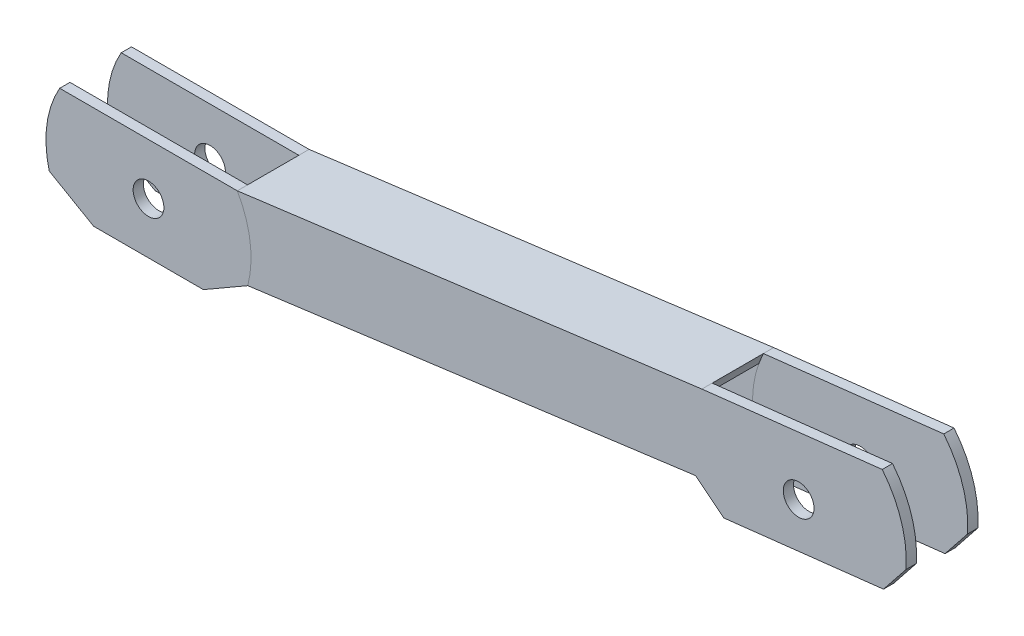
SolidWorks part; units mm, degrees
ref_plane "Plan de face" through (0, 0, 0) normal (0, 0, 1) x (1, 0, 0)
ref_plane "Plan de dessus" through (0, 0, 0) normal (0, 1, 0) x (1, 0, 0)
ref_plane "Plan de droite" through (0, 0, 0) normal (1, 0, 0) x (0, 0, -1)
sketch "Esquisse1" plane through (0, 0, 0) normal (0, 0, 1) x (1, 0, 0)
  line L0 (634, 63) -> (0, 0) construction
  point P0 (634, 63)
  point P1 (0, 0)
  dimension "D1" = 63
  dimension "D2" = 634
sketch "Esquisse2" plane through (0, 0, 0) normal (0, 0, 1) x (1, 0, 0)
  line L0 (0, -131.6719) -> (0, 145.07) construction
  line L1 (-157.388, 0) -> (129.7806, 0) construction
  line L2 (-86.6025, 50) -> (86.6025, 50)
  line L3 (-53.5233, -50) -> (53.5233, -50)
  line L4 (96.8246, -25) -> (53.5233, -50)
  line L5 (-96.8246, -25) -> (-53.5233, -50)
  circle A0 centre (0, 0) radius 15
  arc A1 (-86.6025, 50) -> (-96.8246, -25) centre (0, 0) ccw
  arc A2 (96.8246, -25) -> (86.6025, 50) centre (0, 0) ccw
  dimension "D1" = 30
  dimension "D2" = 200
  dimension "D3" = 100
  dimension "D4" = 30
  dimension "D5" = 25
extrude "Boss.-Extru.1" add sketch "Esquisse2" along normal mid plane 70
sketch "Esquisse3" plane through (0, 0, 0) normal (0, 0, 1) x (1, 0, 0)
  line L0 (-96.8246, -25) -> (-53.5233, -50) construction
  line L1 (-53.5233, -50) -> (53.5233, -50) construction
  line L2 (53.5233, -50) -> (96.8246, -25) construction
  line L3 (-96.8246, -25) -> (-53.5233, -50)
  line L4 (-53.5233, -50) -> (53.5233, -50)
  line L5 (53.5233, -50) -> (96.8246, -25)
  line L6 (-86.6025, 50) -> (86.6025, 50)
  line L8 (86.6025, 50) -> (-86.6025, 50) construction
  arc A0 (-86.6025, 50) -> (-96.8246, -25) centre (0, 0) ccw construction
  arc A1 (96.8246, -25) -> (86.6025, 50) centre (0, 0) ccw construction
  arc A2 (-86.6025, 50) -> (-96.8246, -25) centre (0, 0) ccw
  arc A3 (96.8246, -25) -> (86.6025, 50) centre (0, 0) ccw
extrude "Enlèv. mat.-Extru.1" cut sketch "Esquisse3" against normal mid plane 50
sketch "Esquisse4" plane through (0, 0, 0) normal (0, 0, 1) x (1, 0, 0)
  line L0 (490.4499, 63) -> (795.4884, 63) construction
  line L1 (634, 217.8219) -> (634, -65.1657) construction
  line L2 (539.6701, 109.118) -> (715.5379, 129.1556)
  line L3 (561.0706, 10.9093) -> (716.778, 28.6499)
  line L4 (634, 63) -> (620.6505, 180.1673) construction
  line L5 (533.4013, 32.9185) -> (561.0706, 10.9093)
  line L6 (738.7873, 56.3193) -> (716.778, 28.6499)
  line L7 (634, 63) -> (879.9949, 91.0276) construction
  circle A0 centre (634, 63) radius 15
  arc A1 (738.7873, 56.3193) -> (715.5379, 129.1556) centre (634, 63) ccw
  arc A2 (539.6701, 109.118) -> (533.4013, 32.9185) centre (634, 63) ccw
  dimension "D1" = 30
  dimension "D2" = 210
  dimension "D3" = 6.5
  dimension "D4" = 45
  dimension "D5" = 25
  dimension "D6" = 56.5
  dimension "D7" = 43.5
extrude "Boss.-Extru.2" add sketch "Esquisse4" along normal mid plane 70 separate body
sketch "Esquisse5" plane through (0, 0, 0) normal (0, 0, 1) x (1, 0, 0)
  line L0 (716.778, 28.6499) -> (738.7873, 56.3193) construction
  line L1 (561.0706, 10.9093) -> (716.778, 28.6499) construction
  line L2 (533.4013, 32.9185) -> (561.0706, 10.9093) construction
  line L3 (716.778, 28.6499) -> (738.7873, 56.3193)
  line L4 (561.0706, 10.9093) -> (716.778, 28.6499)
  line L5 (533.4013, 32.9185) -> (561.0706, 10.9093)
  line L6 (715.5379, 129.1556) -> (539.6701, 109.118)
  line L7 (715.5379, 129.1556) -> (539.6701, 109.118) construction
  arc A0 (738.7873, 56.3193) -> (715.5379, 129.1556) centre (634, 63) ccw construction
  arc A1 (539.6701, 109.118) -> (533.4013, 32.9185) centre (634, 63) ccw construction
  arc A2 (738.7873, 56.3193) -> (715.5379, 129.1556) centre (634, 63) ccw
  arc A3 (539.6701, 109.118) -> (533.4013, 32.9185) centre (634, 63) ccw
extrude "Enlèv. mat.-Extru.2" cut sketch "Esquisse5" against normal mid plane 50
sketch "Esquisse6" plane through (0, 0, 0) normal (0, 0, 1) x (1, 0, 0)
  line L0 (86.6025, 50) -> (539.6701, 109.118)
  line L1 (91.4127, 40.5429) -> (535.1636, 98.4452)
  line L3 (-51.4672, 31.9841) -> (753.0189, 136.9566) construction
  line L4 (-50.1734, 22.0682) -> (754.3128, 127.0406) construction
  arc A0 (96.8246, -25) -> (86.6025, 50) centre (0, 0) ccw construction
  arc A1 (91.4127, 40.5429) -> (86.6025, 50) centre (0, 0) ccw
  arc A2 (539.6701, 109.118) -> (533.4013, 32.9185) centre (634, 63) ccw construction
  arc A3 (539.6701, 109.118) -> (535.1636, 98.4452) centre (634, 63) ccw
  dimension "D1" = 10
extrude "Boss.-Extru.4" add sketch "Esquisse6" along normal mid plane 70
sketch "Esquisse7" plane through (0, 0, 35) normal (0, 0, 1) x (1, 0, 0)
  line L1 (86.6025, 50) -> (539.6701, 109.118)
  line L2 (96.8246, -25) -> (533.4013, 32.9185)
  line L3 (539.6701, 109.118) -> (86.6025, 50) construction
  arc A0 (535.1636, 98.4452) -> (533.4013, 32.9185) centre (634, 63) ccw construction
  arc A1 (539.6701, 109.118) -> (533.4013, 32.9185) centre (634, 63) ccw
  arc A3 (96.8246, -25) -> (86.6025, 50) centre (0, 0) ccw
  arc A4 (96.8246, -25) -> (86.6025, 50) centre (0, 0) ccw construction
extrude "Boss.-Extru.5" add sketch "Esquisse7" against normal blind 10
mirror "Symétrie1" about plane through (0, 0, 0) normal (0, 0, 1) of "Boss.-Extru.5"
